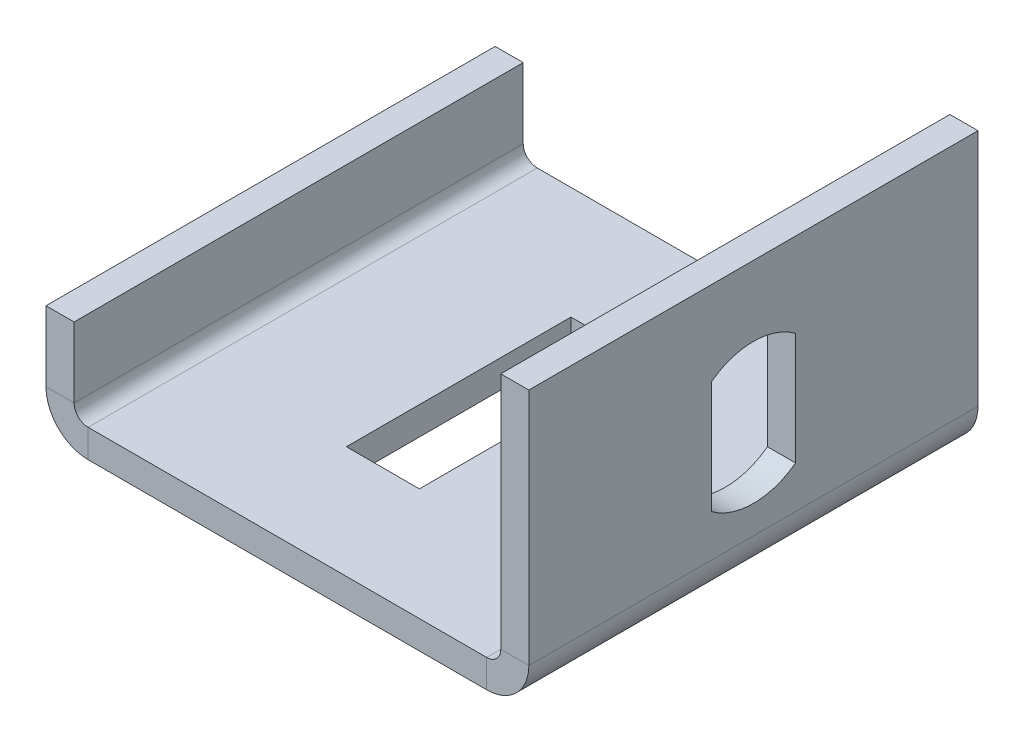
SolidWorks part; units mm, degrees
ref_plane "Front" through (0, 0, 0) normal (0, 0, 1) x (1, 0, 0)
ref_plane "Top" through (0, 0, 0) normal (0, 1, 0) x (1, 0, 0)
ref_plane "Right" through (0, 0, 0) normal (1, 0, 0) x (0, 0, -1)
sketch "Esquisse1" plane through (0, 0, 0) normal (0, 0, 1) x (1, 0, 0)
  line L0 (0, 0) -> (5, 0)
  line L1 (5, 0) -> (5, -10)
  line L2 (10, -15) -> (76, -15)
  line L3 (81, -10) -> (81, 30)
  line L4 (81, 30) -> (86, 30)
  line L5 (86, 30) -> (86, -10)
  line L6 (76, -20) -> (10, -20)
  line L7 (0, -10) -> (0, 0)
  line L8 (76, -15) -> (81, -15)
  line L9 (81, -10) -> (81, -15)
  line L10 (86, -10) -> (86, -20)
  line L11 (76, -20) -> (86, -20)
  line L12 (0, -10) -> (0, -20)
  line L13 (5, -10) -> (5, -15)
  line L14 (5, -15) -> (10, -15)
  line L15 (10, -20) -> (0, -20)
  dimension "D1" = 5
  dimension "D2" = 5
  dimension "D3" = 5
  dimension "D4" = 15
  dimension "D5" = 45
  dimension "D6" = 76
extrude "Base-Extrusion" add sketch "Esquisse1" along normal blind 80
sketch "Esquisse2" plane through (0, -15, 0) normal (0, 1, 0) x (-1, 0, 0)
  line L0 (-40, 25.8299) -> (-40, 75.2931) construction
  line L1 (-33.5, 20) -> (-46.5, 20)
  line L2 (-33.5, 20) -> (-33.5, 60)
  line L3 (-33.5, 60) -> (-46.5, 60)
  line L4 (-46.5, 20) -> (-46.5, 60)
  line L5 (-63.629, 40) -> (-39.0735, 40) construction
  line L7 (-81, 80) -> (-5, 80) construction
  line L8 (-5, 80) -> (-5, 0) construction
  dimension "D1" = 13
  dimension "D2" = 40
  dimension "D3" = 20
  dimension "D4" = 6.5
  dimension "D5" = 35
  dimension "D6" = 40
extrude "Enlèv. mat.-Extru.1" cut sketch "Esquisse2" against normal blind 80
sketch "Esquisse3" plane through (81, 0, 0) normal (-1, 0, 0) x (0, 0, 1)
  line L0 (17.6448, 5) -> (59.0988, 5) construction
  line L1 (40, -9.7861) -> (40, 21.4584) construction
  line L2 (80, 30) -> (0, 30) construction
  line L3 (80, 30) -> (80, -15) construction
  line L4 (32.5, -5) -> (32.5, 15)
  line L5 (47.5, -5) -> (47.5, 15)
  arc A0 (32.5, -5) -> (47.5, -5) centre (40, 5) ccw
  arc A1 (47.5, 15) -> (32.5, 15) centre (40, 5) ccw
  dimension "D1" = 25
  dimension "D2" = 25
  dimension "D3" = 40
  dimension "D4" = 15
  dimension "D5" = 7.5
extrude "Enlèv. mat.-Extru.3" cut sketch "Esquisse3" against normal blind 80
sheet metal parameters "Tôlerie 2" parameters "D1"=2.5, "Epaisseur"=5
bend "Pli dans angle4" bend angle 90 parameters "D1"=0, "D5"=1
flatten bends "Dépliage 2" parameters "D1"=0
sketch "Esquisse-Angle2" plane through (0, -15, 0) normal (0, 1, 0) x (-1, 0, 0)
  line L0 (-80.4713, 80) -> (-80.4713, 0) construction
  line L1 (-5.5287, 0) -> (-5.5287, 80) construction
bend "Pli dans angle3" bend angle 90 parameters "D1"=0, "D5"=2
process bends "Pliage 2" parameters "D1"=0
sketch "Esquisse-Plate2" plane through (0, -15, 0) normal (0, 1, 0) x (-1, 0, 0)
